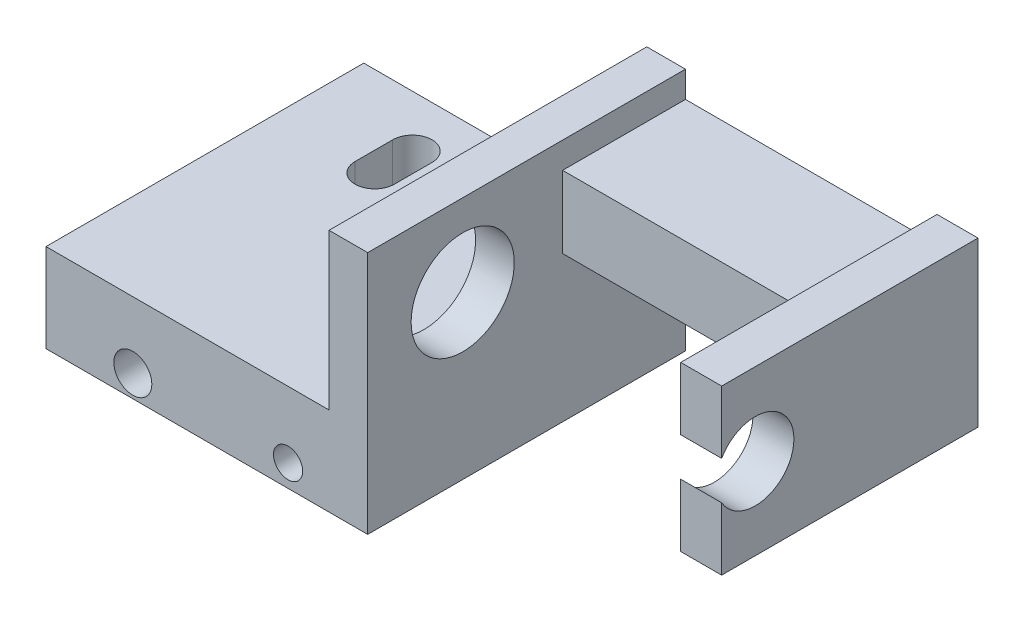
SolidWorks part; units mm, degrees
ref_plane "Front Plane" through (0, 0, 0) normal (0, 0, 1) x (1, 0, 0)
ref_plane "Top Plane" through (0, 0, 0) normal (0, 1, 0) x (1, 0, 0)
ref_plane "Right Plane" through (0, 0, 0) normal (1, 0, 0) x (0, 0, -1)
sketch "Sketch1" plane through (0, 0, 0) normal (0, 1, 0) x (1, 0, 0)
  line L0 (23.8125, 12.319) -> (-23.8125, -12.319) construction
  line L1 (-23.8125, 12.319) -> (23.8125, 12.319)
  line L2 (-23.8125, 12.319) -> (-23.8125, -12.319)
  line L3 (-23.8125, -12.319) -> (23.8125, -12.319)
  line L4 (23.8125, 12.319) -> (23.8125, -12.319)
  point P4 (0, 0)
  dimension "D1" = 47.625
  dimension "D2" = 24.638
extrude "Extrude1" add sketch "Sketch1" along normal blind 18.923
sketch "Sketch2" plane through (0, 18.923, 0) normal (0, 1, 0) x (1, 0, 0)
  line L0 (-23.8125, -12.319) -> (23.8125, -12.319) construction
  line L1 (1.1303, -12.319) -> (20.6375, -12.319)
  line L2 (1.1303, -12.319) -> (1.1303, 2.794)
  line L3 (1.1303, 2.794) -> (20.6375, 2.794)
  line L4 (20.6375, -12.319) -> (20.6375, 2.794)
  line L5 (23.8125, 12.319) -> (-23.8125, 12.319) construction
  line L6 (-23.8125, 12.319) -> (-23.8125, -12.319) construction
  dimension "D1" = 9.525
  dimension "D2" = 24.9428
  dimension "D3" = 44.45
extrude "Cut-Extrude1" cut sketch "Sketch2" against normal through all
sketch "Sketch4" plane through (0, 0, -12.319) normal (0, 0, -1) x (-1, 0, 0)
  line L0 (-23.8125, 18.923) -> (23.8125, 18.923) construction
  line L1 (-1.1303, 0) -> (-20.7707, 0)
  line L2 (-1.1303, 0) -> (-1.1303, 11.303)
  line L3 (-1.1303, 11.303) -> (-20.6375, 11.303)
  line L4 (-20.6375, 6.223) -> (-20.6375, 11.303)
  line L5 (-1.1303, 18.923) -> (-20.6375, 18.923)
  line L6 (-1.1303, 18.923) -> (-1.1303, 16.891)
  line L7 (-1.1303, 16.891) -> (-20.6375, 16.891)
  line L8 (-20.6375, 18.923) -> (-20.6375, 16.891)
  line L9 (-20.6375, 6.223) -> (-23.8125, 6.223)
  line L10 (-23.8125, 18.923) -> (-23.8125, 0) construction
  line L11 (-23.8125, 6.223) -> (-23.8125, 0)
  line L12 (-23.8125, 0) -> (-20.7707, 0)
  line L14 (23.8125, 18.923) -> (23.8125, 0) construction
  line L15 (-23.8125, 0) -> (23.8125, 0) construction
  dimension "D1" = 11.303
  dimension "D3" = 6.223
  dimension "D5" = 44.45
  dimension "D6" = 16.891
extrude "Cut-Extrude2" cut sketch "Sketch4" against normal through all
sketch "Sketch5" plane through (0, 0, 0) normal (0, -1, 0) x (1, 0, 0)
  line L0 (1.1303, -12.319) -> (-23.8125, -12.319) construction
  line L1 (-20.2565, -12.319) -> (-1.8669, -12.319)
  line L2 (-20.2565, -12.319) -> (-20.2565, -1.3462)
  line L3 (-17.0815, 1.8288) -> (-5.0419, 1.8288)
  line L4 (-1.8669, -12.319) -> (-1.8669, -1.3462)
  line L5 (-23.8125, -12.319) -> (-23.8125, 12.319) construction
  arc A0 (-5.0419, 1.8288) -> (-1.8669, -1.3462) centre (-5.0419, -1.3462) cw
  arc A1 (-20.2565, -1.3462) -> (-17.0815, 1.8288) centre (-17.0815, -1.3462) cw
  point P12 (-20.2565, 1.8288)
  dimension "D4" = 3.175
  dimension "D1" = 3.556
  dimension "D2" = 14.1478
  dimension "D3" = 21.9456
extrude "Cut-Extrude3" cut sketch "Sketch5" against normal blind 3.429
sketch "Sketch6" plane through (23.8125, 0, 0) normal (1, 0, 0) x (0, 0, -1)
  line L1 (12.319, 18.923) -> (12.319, 6.223) construction
  line L2 (12.319, 0) -> (-12.319, 0) construction
  circle A0 centre (-4.953, 12.573) radius 2.9997
  dimension "D1" = 5.9995
  dimension "D2" = 12.573
  dimension "D3" = 17.272
extrude "Cut-Extrude4" cut sketch "Sketch6" against normal up to next
sketch "Sketch7" plane through (-23.8125, 0, 0) normal (-1, 0, 0) x (0, 0, 1)
  line L0 (-12.319, 18.923) -> (-12.319, 0) construction
  line L1 (-12.319, 18.923) -> (12.319, 18.923) construction
  circle A0 centre (4.953, 12.573) radius 5.5563
  dimension "D1" = 11.1125
  dimension "D2" = 17.272
  dimension "D3" = 6.35
extrude "Cut-Extrude5" cut sketch "Sketch7" against normal blind 21.9456
hole_wizard "M8x.75 Tapped Hole1" positions "3DSketch1" profile "Sketch8" tap size "M8x1.25" standard "Ansi Metric"
sketch3d "3DSketch1"
  line L0 (-1.8669, 12.573, 4.953) -> (-23.8125, 12.573, 4.953) construction
  point P0 (-1.8669, 12.573, 4.953)
sketch "Sketch8" plane through (-1.8669, 12.573, 4.953) normal (0, 1, 0) x (0, 0, 1)
  line L0 (0, 0) -> (0, 2.9972)
  line L1 (0, 2.9972) -> (4, 2.9972)
  line L2 (4, 2.9972) -> (4, 0)
  line L5 (4, 0) -> (0, 0)
  line L11 (0, -6.35) -> (0, 107.95) construction
  dimension "Thread Major Dia." = 8
  dimension "Thru Tap Drill Depth" = 2.9972
sketch "Sketch9" plane through (0, 18.923, 0) normal (0, 1, 0) x (1, 0, 0)
  line L0 (-23.8125, 12.319) -> (-23.8125, -12.319) construction
  line L1 (-23.8125, 12.319) -> (-1.8669, 12.319)
  line L2 (-23.8125, 12.319) -> (-23.8125, 1.336)
  line L3 (-23.8125, 1.336) -> (-5.0419, 1.336)
  line L4 (-1.8669, 12.319) -> (-1.8669, 4.511)
  line L5 (1.1303, 12.319) -> (-23.8125, 12.319) construction
  arc A1 (-5.0419, 1.336) -> (-1.8669, 4.511) centre (-5.0419, 4.511) ccw
  point P9 (-23.8125, 1.336)
  dimension "D3" = 3.175
  dimension "D1" = 10.983
  dimension "D2" = 21.9456
extrude "Cut-Extrude6" cut sketch "Sketch9" against normal blind 10.16
sketch "Sketch11" plane through (0, 3.429, 0) normal (0, -1, 0) x (1, 0, 0)
  line L0 (-16.0172, -6.8326) -> (-5.9334, -6.8326) construction
  line L1 (-20.2565, -12.319) -> (-1.8669, -12.319) construction
  line L2 (-16.0172, -5.3713) -> (-16.0172, -8.2939) construction
  line L3 (-5.9334, -5.3713) -> (-5.9334, -8.2939) construction
  line L4 (-20.2565, -1.3462) -> (-20.2565, -12.319) construction
  line L5 (-17.5412, -5.3713) -> (-17.5412, -8.2939)
  line L6 (-14.4932, -5.3713) -> (-14.4932, -8.2939)
  line L7 (-7.4574, -5.3713) -> (-7.4574, -8.2939)
  line L8 (-4.4094, -5.3713) -> (-4.4094, -8.2939)
  arc A0 (-14.4932, -5.3713) -> (-17.5412, -5.3713) centre (-16.0172, -5.3713) ccw
  arc A1 (-17.5412, -8.2939) -> (-14.4932, -8.2939) centre (-16.0172, -8.2939) ccw
  arc A3 (-7.4574, -8.2939) -> (-4.4094, -8.2939) centre (-5.9334, -8.2939) ccw
  arc A4 (-4.4094, -5.3713) -> (-7.4574, -5.3713) centre (-5.9334, -5.3713) ccw
  dimension "D2" = 10.0838
  dimension "D5" = 3.048
  dimension "D1" = 4.2393
  dimension "D3" = 5.4864
  dimension "D4" = 2.9225
extrude "Cut-Extrude7" cut sketch "Sketch11" against normal through all
sketch "Sketch12" plane through (0, 0, 12.319) normal (0, 0, 1) x (1, 0, 0)
  line L0 (-17.0815, 3.429) -> (-17.0815, 0) construction
  line L1 (-5.0419, 3.429) -> (-5.0419, 0) construction
  point P0 (-17.0815, 1.7145)
  point P1 (-5.0419, 1.7145)
hole_wizard "#4-40 Tapped Hole2" positions "3DSketch3" profile "Sketch14" tap size "#4-40" standard "Ansi Inch"
sketch3d "3DSketch3"
  point P0 (-5.0419, 1.7145, 12.319)
sketch "Sketch14" plane through (-5.0419, 1.7145, 12.319) normal (1, 0, 0) x (0, -1, 0)
  line L0 (0, 0) -> (0, 24.638)
  line L1 (0, 24.638) -> (1.1303, 24.638)
  line L2 (1.1303, 24.638) -> (1.1303, 0)
  line L5 (1.1303, 0) -> (0, 0)
  line L11 (0, -6.35) -> (0, 107.95) construction
  dimension "Thru Tap Drill Dia." = 2.2606
  dimension "Thru Tap Drill Depth" = 24.638
hole_wizard "#4 Clearance Hole1" positions "3DSketch4" profile "Sketch15" hole size "#4" standard "Ansi Inch"
sketch3d "3DSketch4"
  point P0 (-17.0815, 1.7145, 12.319)
sketch "Sketch15" plane through (-17.0815, 1.7145, 12.319) normal (1, 0, 0) x (0, -1, 0)
  line L0 (0, 0) -> (0, 24.638)
  line L1 (0, 24.638) -> (1.4732, 24.638)
  line L2 (1.4732, 24.638) -> (1.4732, 0)
  line L5 (1.4732, 0) -> (0, 0)
  line L11 (0, -6.35) -> (0, 107.95) construction
  dimension "Thru Hole Dia." = 2.9464
  dimension "Thru Hole Depth" = 24.638
sketch "Sketch16" plane through (23.8125, 0, 0) normal (1, 0, 0) x (0, 0, -1)
  line L0 (-12.319, 18.923) -> (-12.319, 6.223) construction
  line L1 (-13.4326, 19.115) -> (-7.5565, 19.115)
  line L2 (-13.4326, 19.115) -> (-13.4326, 5.8519)
  line L3 (-13.4326, 5.8519) -> (-7.5565, 5.8519)
  line L4 (-7.5565, 19.115) -> (-7.5565, 5.8519)
  dimension "D1" = 4.7625
extrude "Cut-Extrude8" cut sketch "Sketch16" against normal blind 3.175
sketch "Sketch17" plane through (0, 0, -12.319) normal (0, 0, -1) x (-1, 0, 0)
  line L0 (23.8125, 8.763) -> (23.8125, 0) construction
  line L1 (1.8669, 18.923) -> (23.8125, 18.923)
  line L2 (1.8669, 18.923) -> (1.8669, 6.858)
  line L3 (1.8669, 6.858) -> (23.8125, 6.858)
  line L4 (23.8125, 18.923) -> (23.8125, 6.858)
  line L5 (5.0419, 0) -> (17.0815, 0) construction
  dimension "D1" = 6.858
extrude "Extrude2" cut sketch "Sketch17" against normal through all
